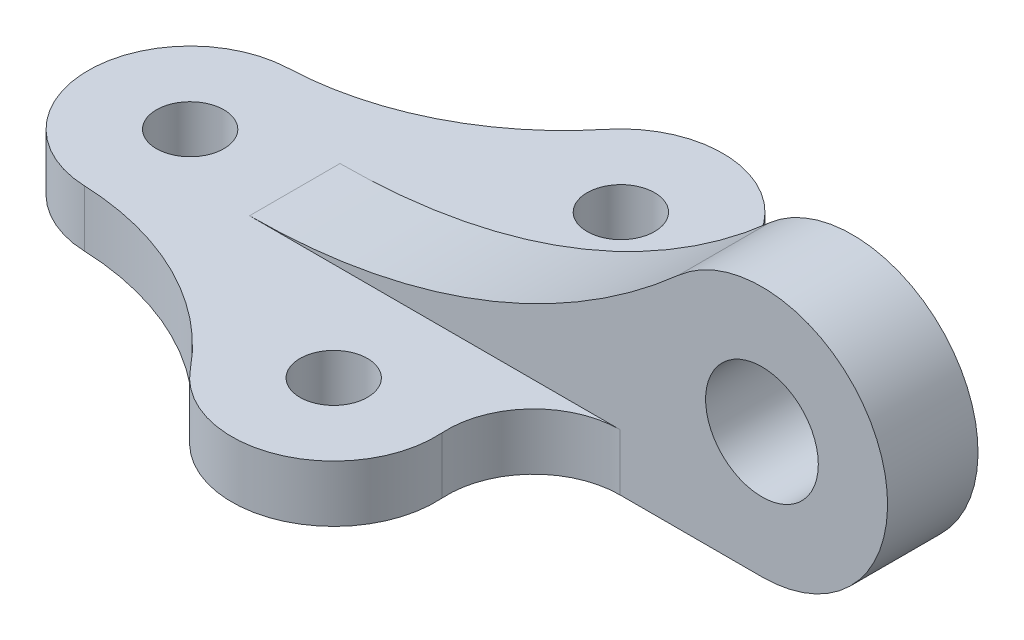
SolidWorks part; units mm, degrees
ref_plane "Front Plane" through (0, 0, 0) normal (0, 0, 1) x (1, 0, 0)
ref_plane "Top Plane" through (0, 0, 0) normal (0, 1, 0) x (1, 0, 0)
ref_plane "Right Plane" through (0, 0, 0) normal (1, 0, 0) x (0, 0, -1)
sketch "Sketch1" plane through (0, 0, 0) normal (0, 1, 0) x (1, 0, 0)
  line L0 (0, 0) -> (50.8, 0) construction
  line L1 (50.8, -25.4) -> (50.8, 0) construction
  line L2 (50.8, 25.4) -> (50.8, 0) construction
  line L4 (50.8, 0) -> (113.8178, 0) construction
  line L5 (84.0039, 8.001) -> (84.0039, 0)
  line L6 (84.0039, -8.001) -> (84.0039, 0)
  arc A0 (-0.6921, 18.0207) -> (-0.6921, -18.0207) centre (0, 0) ccw
  arc A1 (68.796, 24.2299) -> (36.7987, 36.7661) centre (50.8, 25.4) ccw
  arc A2 (36.7987, -36.7661) -> (68.796, -24.2299) centre (50.8, -25.4) ccw
  circle A3 centre (0, 0) radius 5.969
  circle A4 centre (50.8, 25.4) radius 5.969
  circle A5 centre (50.8, -25.4) radius 5.969
  arc A6 (-0.6921, 18.0207) -> (36.7987, 36.7661) centre (-2.6416, 68.7833) ccw
  arc A7 (36.7987, -36.7661) -> (-0.6921, -18.0207) centre (-2.6416, -68.7833) ccw
  arc A8 (68.796, 24.2299) -> (84.0039, 8.001) centre (84.0039, 23.241) ccw
  arc A9 (84.0039, -8.001) -> (68.796, -24.2299) centre (84.0039, -23.241) ccw
  dimension "D2" = 36.068
  dimension "D4" = 50.8
  dimension "D5" = 11.938
  dimension "D6" = 15.24
  dimension "D1" = 50.8
  dimension "D3" = 50.8
  dimension "D7" = 8.001
extrude "Boss-Extrude3" add sketch "Sketch1" along normal blind 10.0076
sketch "Sketch5" plane through (0, 0, 0) normal (0, 0, 1) x (1, 0, 0)
  line L0 (109.1629, 0) -> (18.5085, 0)
  line L1 (-0.6921, 0) -> (36.7987, 0) construction
  line L2 (36.7987, 10.0076) -> (-0.6921, 10.0076) construction
  line L3 (18.5085, 10.0076) -> (18.5085, 0)
  circle A0 centre (109.1629, 22.225) radius 9.9695
  arc A1 (109.1629, 0) -> (94.4052, 38.8431) centre (109.1629, 22.225) ccw
  arc A2 (18.5085, 10.0076) -> (94.4052, 38.8431) centre (18.5085, 124.3076) ccw
  dimension "D1" = 114.3
  dimension "D2" = 44.45
  dimension "D4" = 19.939
  dimension "D3" = 109.855
extrude "Boss-Extrude4" add sketch "Sketch5" along normal mid plane 16.002
